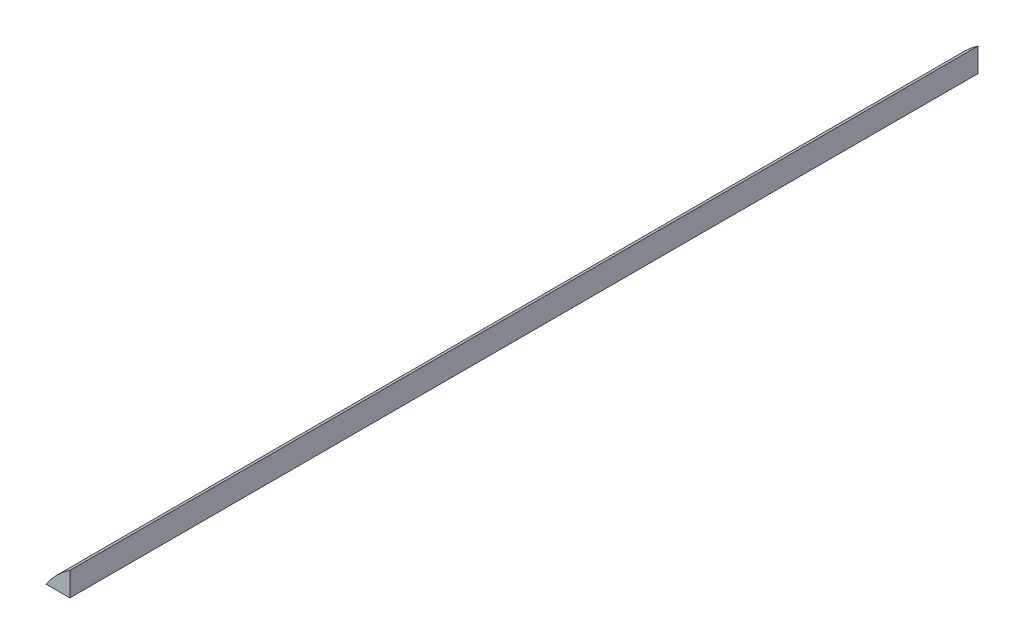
SolidWorks part; units mm, degrees
ref_plane "Front Plane" through (0, 0, 0) normal (0, 0, 1) x (1, 0, 0)
ref_plane "Top Plane" through (0, 0, 0) normal (0, 1, 0) x (1, 0, 0)
ref_plane "Right Plane" through (0, 0, 0) normal (1, 0, 0) x (0, 0, -1)
sketch "Sketch1" plane through (0, 0, 0) normal (0, 0, 1) x (1, 0, 0)
  circle A0 centre (0, 0) radius 19.05
  dimension "D1" = 38.1
extrude "Extrude1" add sketch "Sketch1" along normal blind 203.2
sketch "Sketch2" plane through (0, 0, 203.2) normal (0, 0, 1) x (1, 0, 0)
  line L1 (-15.875, 10.5303) -> (15.875, 10.5303)
  circle A0 centre (0, 0) radius 19.05 construction
  arc A1 (-15.875, 10.5303) -> (15.875, 10.5303) centre (0, 0) ccw
  dimension "D2" = 31.75
extrude "Cut-Extrude1" cut sketch "Sketch2" against normal through all
sketch "Sketch5" plane through (0, 0, 203.2) normal (0, 0, 1) x (1, 0, 0)
  line L0 (-15.875, 10.5303) -> (-10.541, 10.5303)
  line L1 (15.875, 10.5303) -> (-15.875, 10.5303) construction
  line L2 (-10.541, 10.5303) -> (-10.541, 15.8679)
  arc A0 (15.875, 10.5303) -> (-15.875, 10.5303) centre (0, 0) ccw construction
  arc A1 (-15.875, 10.5303) -> (-10.541, 15.8679) centre (0, 0) cw
  dimension "D1" = 5.334
extrude "Cut-Extrude2" cut sketch "Sketch5" against normal through all flip side to cut
